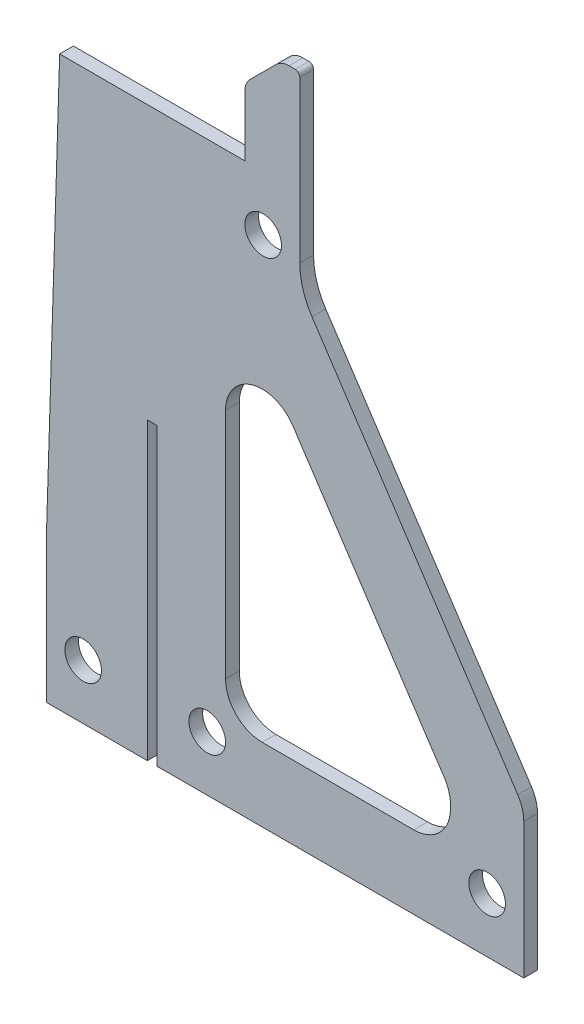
SolidWorks part; units mm, degrees
ref_plane "Front Plane" through (0, 0, 0) normal (0, 0, 1) x (1, 0, 0)
ref_plane "Top Plane" through (0, 0, 0) normal (0, 1, 0) x (1, 0, 0)
ref_plane "Right Plane" through (0, 0, 0) normal (1, 0, 0) x (0, 0, -1)
sketch "Sketch2" plane through (0, 0, 0) normal (0, 0, 1) x (1, 0, 0)
  line L0 (0, 0) -> (0, 204.47) construction
  line L1 (3.429, 0) -> (3.429, 204.47)
  line L2 (-3.429, 0) -> (-3.429, 204.47)
  line L3 (-3.429, 204.47) -> (3.429, 204.47)
  line L4 (-3.429, 0) -> (-73.279, 0)
  line L5 (-73.279, 0) -> (-73.279, 101.6)
  line L6 (-73.279, 101.6) -> (-64.135, 393.7)
  line L7 (-64.135, 393.7) -> (64.135, 393.7)
  line L8 (257.429, 0) -> (257.429, 101.6)
  line L9 (257.429, 0) -> (3.429, 0)
  line L10 (257.429, 101.6) -> (110.6707, 323.3766)
  line L11 (0, 393.7) -> (0, 204.47) construction
  line L12 (202.4111, 92.6877) -> (97.3821, 251.4043)
  line L13 (206.629, 76.2) -> (206.629, 78.6706)
  line L14 (181.229, 50.8) -> (76.2, 50.8)
  line L15 (50.8, 237.3873) -> (50.8, 76.2)
  line L16 (50.8, 393.7) -> (50.8, 204.47) construction
  line L17 (257.429, 50.8) -> (3.429, 50.8) construction
  line L18 (215.0647, 73.5659) -> (21.7707, 365.6659) construction
  line L19 (206.629, 0) -> (206.629, 101.6) construction
  line L20 (64.135, 393.7) -> (64.135, 435.4295)
  line L21 (67.8547, 444.4097) -> (85.8153, 462.3703)
  line L22 (94.7955, 466.09) -> (99.06, 466.09)
  line L23 (102.235, 462.915) -> (102.235, 351.4107)
  line L24 (257.429, 101.6) -> (64.135, 393.7) construction
  arc A0 (206.629, 76.2) -> (181.229, 50.8) centre (181.229, 76.2) cw
  arc A1 (206.629, 78.6706) -> (202.4111, 92.6877) centre (181.229, 78.6706) ccw
  arc A2 (76.2, 50.8) -> (50.8, 76.2) centre (76.2, 76.2) cw
  arc A3 (97.3821, 251.4043) -> (50.8, 237.3873) centre (76.2, 237.3873) ccw
  circle A4 centre (-47.879, 38.1) radius 12.7
  arc A5 (110.6707, 323.3766) -> (102.235, 351.4107) centre (153.035, 351.4107) cw
  arc A6 (64.135, 435.4295) -> (67.8547, 444.4097) centre (76.835, 435.4295) cw
  arc A7 (94.7955, 466.09) -> (85.8153, 462.3703) centre (94.7955, 453.39) ccw
  arc A8 (102.235, 462.915) -> (99.06, 466.09) centre (99.06, 462.915) ccw
  circle A9 centre (76.835, 355.6) radius 12.7
  circle A10 centre (38.1, 38.1) radius 12.7
  circle A11 centre (232.029, 38.1) radius 12.7
  point P44 (64.135, 440.69)
  point P47 (89.535, 466.09)
  point P50 (102.235, 466.09)
  dimension "D14" = 25.4
  dimension "D15" = 25.4
  dimension "D16" = 25.4
  dimension "D17" = 38.1
  dimension "D22" = 50.8
  dimension "D23" = 12.7
  dimension "D24" = 3.175
  dimension "D25" = 38.1
  dimension "D27" = 25.4
  dimension "D1" = 189.23
  dimension "D4" = 393.7
  dimension "D5" = 254
  dimension "D6" = 128.27
  dimension "D7" = 69.85
  dimension "D8" = 101.6
  dimension "D9" = 101.6
  dimension "D18" = 46.99
  dimension "D19" = 25.4
  dimension "D20" = 12.7
  dimension "D21" = 25.4
  dimension "D26" = 25.4
  dimension "D28" = 38.1
  dimension "D2" = 3.429
  dimension "D3" = 3.429
  dimension "D10" = 50.8
  dimension "D11" = 50.8
  dimension "D12" = 50.8
  dimension "D13" = 50.8
extrude "Boss-Extrude1" add sketch "Sketch2" along normal mid plane 9.525
fillet "Fillet1" radius 25.4 2 edges at (-73.279, 101.6, 0) (257.429, 101.6, 0)
